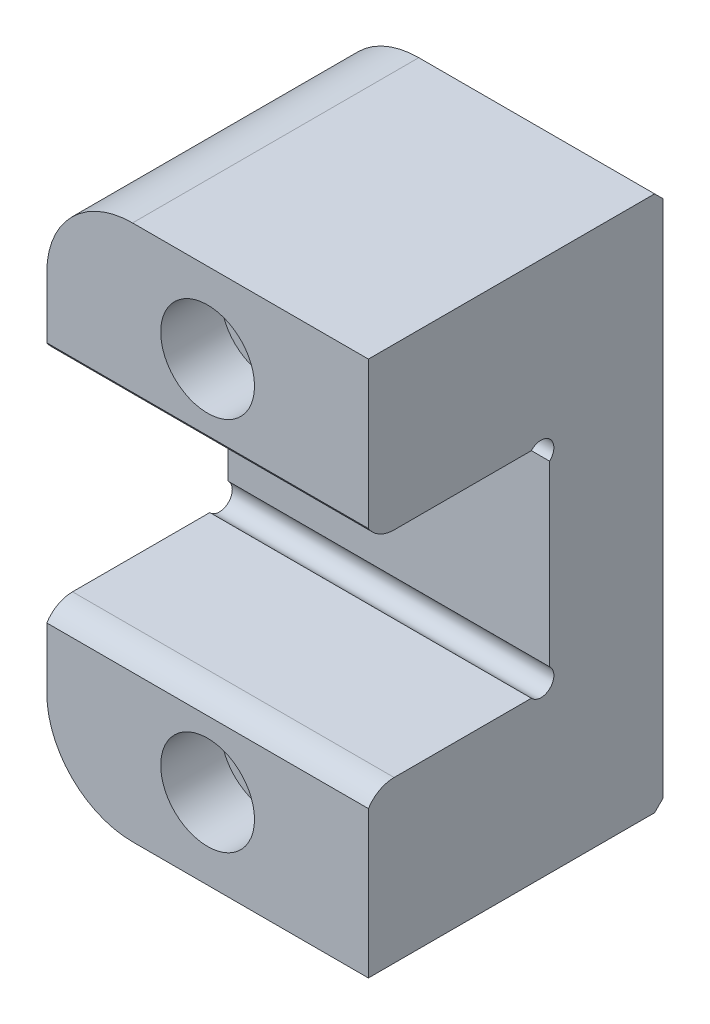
SolidWorks part; units mm, degrees
ref_plane "Front Plane" through (0, 0, 0) normal (0, 0, 1) x (1, 0, 0)
ref_plane "Top Plane" through (0, 0, 0) normal (0, 1, 0) x (1, 0, 0)
ref_plane "Right Plane" through (0, 0, 0) normal (1, 0, 0) x (0, 0, -1)
sketch "Sketch1" plane through (0, 0, 0) normal (1, 0, 0) x (0, 0, -1)
  line L0 (0, 0) -> (50000, 0) construction
  line L1 (0, 12.7) -> (21.463, 12.7)
  line L2 (0, 31.75) -> (34.925, 31.75)
  line L3 (0, 31.75) -> (0, 12.7)
  line L4 (0, -31.75) -> (34.925, -31.75)
  line L5 (34.925, 31.75) -> (34.925, -31.75)
  line L6 (21.463, 12.7) -> (21.463, -12.7)
  line L7 (21.463, -12.7) -> (0, -12.7)
  line L9 (0, 15.7163) -> (0, -15.7163) construction
  line L10 (0, -12.7) -> (0, -31.75)
  dimension "D1" = 34.925
  dimension "D2" = 63.5
  dimension "D3" = 21.463
  dimension "D4" = 25.4
extrude "Extrude1" add sketch "Sketch1" along normal mid plane 38.1
fillet "Fillet1" radius 10.16 2 edges at (-19.05, -31.75, -17.4625) (-19.05, 31.75, -17.4625)
sketch "Sketch2" plane through (-15.875, 0, -34.925) normal (0, 0, 1) x (1, 0, 0)
  line L0 (0, 0) -> (50000, 0) construction
  line L1 (34.925, -31.75) -> (34.925, 31.75) construction
  line L2 (33.3375, 5.4335) -> (36.5125, 7.2665) construction
  line L3 (33.3375, 5.4335) -> (33.3375, -5.4335) construction
  line L4 (33.3375, -5.4335) -> (36.5125, -7.2665) construction
  line L5 (36.5125, 7.2665) -> (36.5125, -7.2665) construction
  line L6 (15.875, 0) -> (15.875, 50000) construction
  line L7 (-4.7625, 7.2665) -> (-4.7625, -7.2665)
  line L8 (-1.5875, -5.4335) -> (-4.7625, -7.2665)
  line L9 (-1.5875, 5.4335) -> (-1.5875, -5.4335)
  line L10 (-1.5875, 5.4335) -> (-4.7625, 7.2665)
  point P4 (34.925, 6.35)
  point P10 (34.925, -6.35)
  point P13 (-3.175, -6.35)
  point P14 (-3.175, 6.35)
  dimension "D1" = 12.7
  dimension "D2" = 1.5875
  dimension "D3" = 30
  dimension "D4" = 3.175
extrude "Cut-Extrude1" cut sketch "Sketch2" along normal through all
sketch "Sketch5" plane through (19.05, 0, 0) normal (1, 0, 0) x (0, 0, -1)
  line L0 (0, 0) -> (50000, 0) construction
  line L2 (0, 31.75) -> (0, 12.7) construction
  line L3 (0, -12.7) -> (0, -31.75) construction
  line L4 (-3.302, -11.1955) -> (3.048, -11.1955)
  line L5 (-3.302, -11.1955) -> (-3.302, -14.3705)
  line L6 (-3.302, -14.3705) -> (0, -14.3705)
  line L7 (3.048, -11.1955) -> (3.048, -12.7)
  line L8 (21.463, -12.7) -> (0, -12.7) construction
  line L9 (3.048, 11.1955) -> (3.048, 12.7)
  line L10 (-3.302, 14.3705) -> (0, 14.3705)
  line L11 (-3.302, 11.1955) -> (-3.302, 14.3705)
  line L12 (-3.302, 11.1955) -> (3.048, 11.1955)
  arc A0 (1.2337, -12.8744) -> (3.048, -12.7) centre (3.048, -22.225) cw construction
  arc A1 (0, -14.3705) -> (1.2337, -12.8744) centre (1.524, -14.3705) cw construction
  arc A2 (0, 14.3705) -> (1.2337, 12.8744) centre (1.524, 14.3705) ccw construction
  arc A3 (1.2337, 12.8744) -> (3.048, 12.7) centre (3.048, 22.225) ccw construction
  arc A4 (0, -14.3705) -> (3.048, -12.7) centre (3.048, -16.316) cw
  arc A5 (0, 14.3705) -> (3.048, 12.7) centre (3.048, 16.316) ccw
  dimension "D1" = 1.524
  dimension "D2" = 9.525
  dimension "D3" = 3.175
  dimension "D4" = 6.35
  dimension "D5" = 3.048
extrude "Cut-Extrude2" cut sketch "Sketch5" against normal through all
sketch "Sketch6" plane through (19.05, 0, 0) normal (1, 0, 0) x (0, 0, -1)
  line L0 (0, 0) -> (50000, 0) construction
  line L3 (21.463, 12.7) -> (21.463, -12.7) construction
  line L4 (3.048, 12.7) -> (21.463, 12.7) construction
  circle A0 centre (20.447, 11.684) radius 1.524
  circle A1 centre (20.447, -11.684) radius 1.524
  dimension "D2" = 0.508
  dimension "D3" = 1.524
  dimension "D1" = 0.508
extrude "Cut-Extrude3" cut sketch "Sketch6" against normal through all
hole_wizard "1/4\"-20 CBORE" positions "Sketch4" profile "Sketch3" counterbore size "1/4" standard "Ansi Inch"
sketch "Sketch4" plane through (0, 0, 0) normal (0, 0, 1) x (1, 0, 0)
  line L0 (0, 0) -> (0, 50000) construction
  line L1 (0, 0) -> (50000, 0) construction
  point P0 (0, 22.225)
  point P12 (0, -22.225)
  dimension "D1" = 44.45
sketch "Sketch3" plane through (0, 22.225, 0) normal (1, 0, 0) x (0, -1, 0)
  line L0 (0, 0) -> (0, 34.925)
  line L1 (0, 34.925) -> (3.5712, 34.925)
  line L3 (3.5712, 34.925) -> (3.5712, 7.1437)
  line L4 (3.5712, 7.1437) -> (5.5562, 7.1437)
  line L5 (5.5562, 7.1437) -> (5.5562, 0)
  line L7 (5.5562, 0) -> (0, 0)
  line L11 (0, -6.35) -> (0, 107.95) construction
  dimension "Thru Hole Dia." = 7.1425
  dimension "Thru Hole Depth" = 34.925
  dimension "C'Bore Dia." = 11.1125
  dimension "C'Bore Depth" = 7.1437
chamfer "Chamfer3" distance 3.81 angle 15 1 edges at (-17.4625, 0, -21.463)
chamfer "Chamfer1" distance 1.016 angle 45 6 edges at (-19.05, -13.97, -34.925) (-16.0742, -28.7742, -34.925) (5.08, -31.75, -34.925) (5.08, 31.75, -34.925) (-19.05, 13.97, -34.925) (-16.0742, 28.7742, -34.925)
